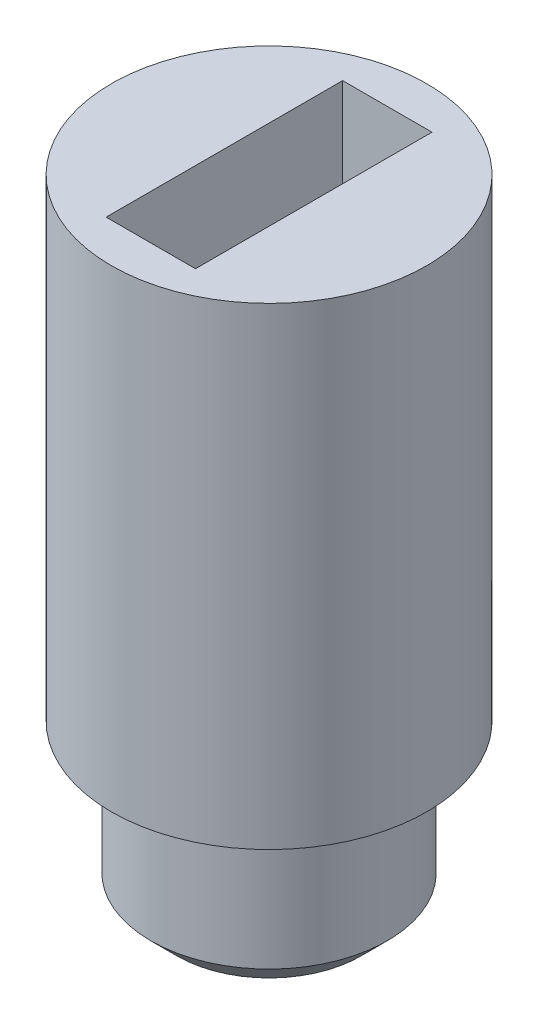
SolidWorks part; units mm, degrees
ref_plane "Front" through (0, 0, 0) normal (0, 0, 1) x (1, 0, 0)
ref_plane "Top" through (0, 0, 0) normal (0, 1, 0) x (1, 0, 0)
ref_plane "Right" through (0, 0, 0) normal (1, 0, 0) x (0, 0, -1)
sketch "Sketch1" plane through (0, 0, 0) normal (1, 0, 0) x (0, 0, -1)
  line L0 (0, 0) -> (0, 12)
  line L1 (0, 12) -> (3, 12)
  line L2 (3, 12) -> (3, 3)
  line L3 (3, 3) -> (2.25, 3)
  line L4 (2.25, 3) -> (2.25, 0)
  line L5 (2.25, 0) -> (0, 0)
  line L6 (0, 0) -> (0, -26.276) construction
  dimension "D1" = 6
  dimension "D2" = 4.5
  dimension "D3" = 3
  dimension "D4" = 12
revolve "Revolve1" add sketch "Sketch1" angle 360 about L6
sketch "Sketch2" plane through (0, 12, 0) normal (0, 1, 0) x (1, 0, 0)
  line L1 (-0.85, -2.25) -> (0.85, -2.25)
  line L2 (-0.85, -2.25) -> (-0.85, 2.25)
  line L3 (-0.85, 2.25) -> (0.85, 2.25)
  line L4 (0.85, -2.25) -> (0.85, 2.25)
  line L5 (-0.85, -2.25) -> (0.85, 2.25) construction
  line L6 (-0.85, 2.25) -> (0.85, -2.25) construction
  point P0 (0, 0)
  dimension "D1" = 1.7
  dimension "D2" = 4.5
extrude "Cut-Extrude1" cut sketch "Sketch2" against normal blind 2
chamfer "Chamfer1" distance 0.5 angle 45 1 edges at (0, 0, 2.25)
sketch "Sketch3" plane through (0, 0, 0) normal (1, 0, 0) x (0, 0, -1)
  point P0 (-2.25, 3)
